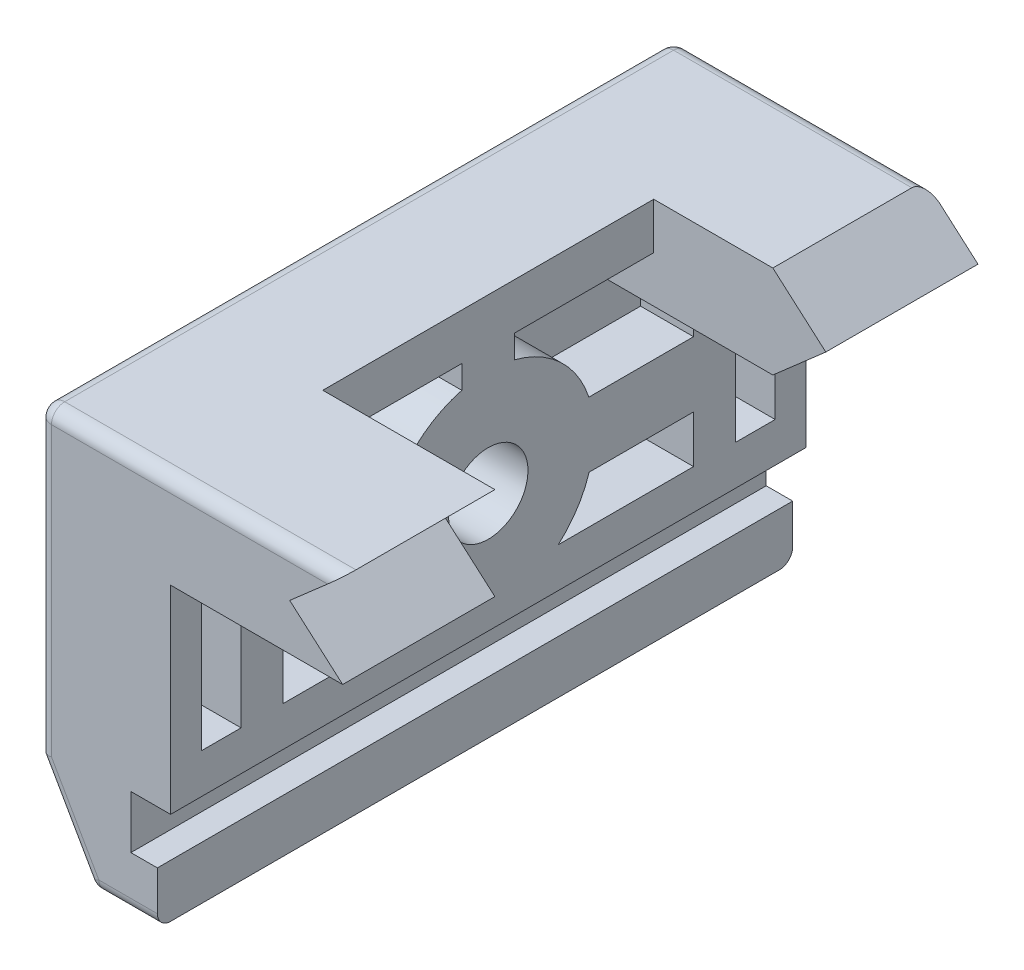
SolidWorks part; units mm, degrees
ref_plane "Plane1" through (0, 0, 0) normal (0, 0, 1) x (1, 0, 0)
ref_plane "Plane2" through (0, 0, 0) normal (0, 1, 0) x (1, 0, 0)
ref_plane "Plane3" through (0, 0, 0) normal (1, 0, 0) x (0, 0, -1)
sketch "Esquisse1" plane through (0, 0, 0) normal (0, 0, 1) x (1, 0, 0)
  line L0 (0, 0) -> (4, 0)
  line L1 (4, 0) -> (4, -7)
  line L2 (4, -7) -> (-9, -7)
  line L3 (-9, -7) -> (-9, -22)
  line L4 (-10, -30) -> (-15, -30)
  line L5 (-19, 0) -> (-19, -23)
  line L6 (-19, -23) -> (-15, -30)
  line L11 (-19, 0) -> (0, 0)
  line L12 (-9, -22) -> (-12, -22)
  line L13 (-12, -22) -> (-12, -26)
  line L14 (-12, -26) -> (-10, -26)
  line L15 (-10, -26) -> (-10, -30)
  dimension "D1" = 7
  dimension "D2" = 26
  dimension "D3" = 3
  dimension "D4" = 22
  dimension "D5" = 30
  dimension "D6" = 23
  dimension "D7" = 10
  dimension "D8" = 4
  dimension "D9" = 7
extrude "Base-Extrusion" add sketch "Esquisse1" along normal blind 48
sketch "Esquisse2" plane through (0, -7, 0) normal (0, -1, 0) x (1, 0, 0)
  line L0 (4, 36.5) -> (-9, 36.5)
  line L1 (4, 36.5) -> (4, 11.5)
  line L2 (-9, 11.5) -> (4, 11.5)
  line L3 (-9, 11.5) -> (-9, 36.5)
  line L4 (4, 48) -> (4, 0) construction
  line L5 (4, 48) -> (-9, 48) construction
  line L6 (4, 0) -> (-9, 0) construction
  dimension "D1" = 11.5
  dimension "D2" = 25
  dimension "D3" = 11.5
  dimension "D4" = 13
extrude "Enlèv. mat.-Extru.1" cut sketch "Esquisse2" against normal blind 48
sketch "Esquisse4" plane through (0, 0, 48) normal (0, 0, 1) x (1, 0, 0)
  line L0 (4, 0) -> (4, -7)
  line L4 (4, 0) -> (4, -7) construction
  line L5 (0, -3.5) -> (4, 0)
  line L6 (4, -7) -> (0, -3.5)
extrude "Enlèv. mat.-Extru.2" cut sketch "Esquisse4" against normal blind 15
sketch "Esquisse5" plane through (0, 0, 0) normal (0, 0, -1) x (-1, 0, 0)
  line L0 (0, 0) -> (-4, 0)
  line L1 (19, 0) -> (-4, 0) construction
  line L2 (-4, 0) -> (-4, -3.5)
  line L3 (-4, 0) -> (-4, -7) construction
  line L4 (-4, -3.5) -> (0, 0)
  dimension "D1" = 3.5
  dimension "D2" = 4
extrude "Enlèv. mat.-Extru.3" cut sketch "Esquisse5" against normal blind 15
sketch "Esquisse6" plane through (0, 0, 0) normal (0, 0, -1) x (-1, 0, 0)
  line L0 (-4, -3.5) -> (0, -7)
  line L1 (-4, -7) -> (9, -7) construction
  line L2 (0, -7) -> (-4, -7)
  line L3 (-4, -7) -> (-4, -3.5)
extrude "Enlèv. mat.-Extru.4" cut sketch "Esquisse6" against normal blind 15
fillet "Congé1" radius 1
fillet "Congé2" radius 1
fillet "Congé3" radius 1
fillet "Congé4" radius 1
sketch "Esquisse7" plane through (-9, 0, 0) normal (1, 0, 0) x (0, 0, -1)
  line L0 (-48, -7) -> (-48, -22) construction
  line L1 (-36.5, 0) -> (-11.5, 0) construction
  circle A0 centre (-24, -13) radius 3
  dimension "D1" = 6
  dimension "D2" = 24
  dimension "D3" = 13
extrude "Enlèv. mat.-Extru.5" cut sketch "Esquisse7" against normal blind 15
sketch "Esquisse8" plane through (-9, 0, 0) normal (1, 0, 0) x (0, 0, -1)
  line L0 (-36.5, -3.5) -> (-25.999, -3.5)
  line L1 (-36.5, -3.5) -> (-36.5, -7)
  line L2 (-36.5, -7) -> (-39.5083, -7)
  line L3 (-48, -7) -> (-36.5, -7) construction
  line L4 (-39.5083, -7) -> (-39.5083, -10.5)
  line L5 (-39.5083, -10.5) -> (-31.5993, -10.5)
  line L6 (-25.999, -5.2538) -> (-25.999, -3.5)
  line L7 (-24, -13) -> (-24, 10.6967) construction
  line L8 (-22.001, -5.2538) -> (-22.001, -3.5)
  line L9 (-11.5, -3.5) -> (-22.001, -3.5)
  line L10 (-11.5, -3.5) -> (-11.5, -7)
  line L11 (-11.5, -7) -> (-8.4917, -7)
  line L12 (-8.4917, -7) -> (-8.4917, -10.5)
  line L13 (-8.4917, -10.5) -> (-16.4007, -10.5)
  line L14 (-45.6765, -7) -> (-42.6765, -7)
  line L15 (-45.6765, -7) -> (-45.6765, -19)
  line L17 (-42.6765, -7) -> (-42.6765, -19)
  line L19 (-42.6765, -19) -> (-45.6765, -19)
  line L20 (-2.3235, -7) -> (-5.3235, -7)
  line L21 (-2.3235, -7) -> (-2.3235, -19)
  line L22 (-5.3235, -19) -> (-2.3235, -19)
  line L23 (-5.3235, -7) -> (-5.3235, -19)
  line L24 (-39.5083, -15.42) -> (-39.5083, -19)
  line L25 (-39.5083, -19) -> (-29.2915, -19)
  line L26 (-39.5083, -15.42) -> (-31.6252, -15.42)
  line L27 (-40.8322, -13) -> (-24, -13) construction
  line L28 (-8.4917, -15.42) -> (-8.4917, -19)
  line L29 (-8.4917, -15.42) -> (-16.3748, -15.42)
  line L30 (-8.4917, -19) -> (-18.7085, -19)
  arc A0 (-25.999, -5.2538) -> (-31.5993, -10.5) centre (-24, -13) ccw
  arc A1 (-31.6252, -15.42) -> (-29.2915, -19) centre (-24, -13) ccw
  arc A2 (-18.7085, -19) -> (-16.3748, -15.42) centre (-24, -13) ccw
  arc A3 (-16.4007, -10.5) -> (-22.001, -5.2538) centre (-24, -13) ccw
  dimension "D1" = 16
  dimension "D2" = 7
  dimension "D3" = 12
extrude "Enlèv. mat.-Extru.6" cut sketch "Esquisse8" against normal blind 4
sketch "Esquisse9" plane through (-19, 0, 0) normal (-1, 0, 0) x (0, 0, 1)
  line L0 (24, -10) -> (28, -10)
  line L2 (28, -16) -> (20, -16)
  line L4 (20, -10) -> (24, -10)
  circle A0 centre (24, -13) radius 3 construction
  arc A1 (28, -16) -> (28, -10) centre (28, -13) ccw
  arc A2 (20, -10) -> (20, -16) centre (20, -13) ccw
  dimension "D4" = 6
  dimension "D5" = 6
  dimension "D1" = 6
extrude "Enlèv. mat.-Extru.7" cut sketch "Esquisse9" against normal blind 5
